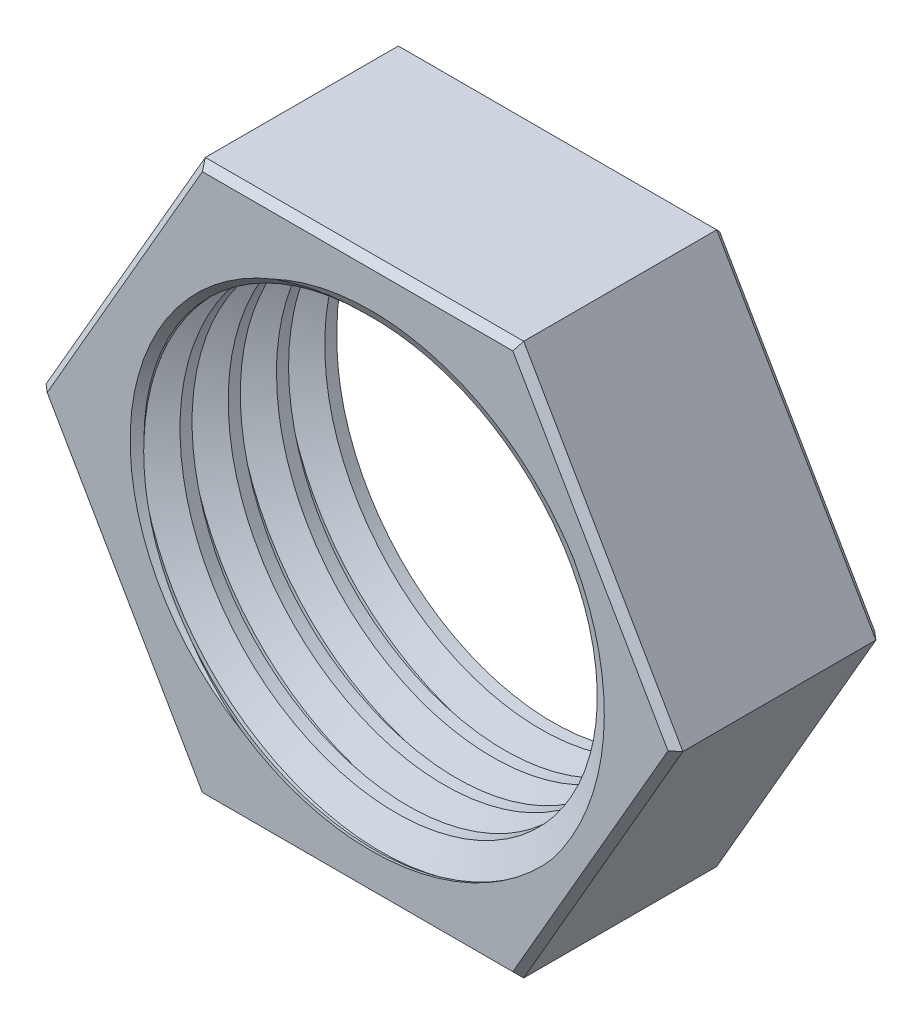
SolidWorks part; units mm, degrees
ref_plane "Front Plane" through (0, 0, 0) normal (0, 0, 1) x (1, 0, 0)
ref_plane "Top Plane" through (0, 0, 0) normal (0, 1, 0) x (1, 0, 0)
ref_plane "Right Plane" through (0, 0, 0) normal (1, 0, 0) x (0, 0, -1)
sketch "Sketch1" plane through (0, 0, 0) normal (0, 0, 1) x (1, 0, 0)
  line L1 (-23.094, 0) -> (-11.547, -20)
  line L2 (-11.547, -20) -> (11.547, -20)
  line L3 (11.547, -20) -> (23.094, 0)
  line L4 (23.094, 0) -> (11.547, 20)
  line L5 (11.547, 20) -> (-11.547, 20)
  line L6 (-11.547, 20) -> (-23.094, 0)
  circle A0 centre (0, 0) radius 20 construction
  circle A1 centre (0, 0) radius 16
  dimension "D2" = 32
  dimension "D1" = 40
extrude "Boss-Extrude1" add sketch "Sketch1" along normal blind 15
thread "Thread1" pitch 3.5 start angle 0, offset 3, length 20, pitch 3.5, diameter 32
ref_plane "Plane1" through (-16, 0, 18) normal (0, -1, 0) x (-1, 0, 0)
sketch "Thread Profile1" plane through (-16, 0, 18) normal (0, -1, 0) x (-1, 0, 0)
  line L0 (0, 0) -> (0, 3.5) construction
  line L1 (0, 0) -> (1.8944, 1.0937)
  line L2 (1.8944, 1.0937) -> (1.8944, 1.5312)
  line L3 (1.8944, 1.5312) -> (0, 2.625)
  line L4 (1.8944, 1.3125) -> (0, 1.3125) construction
  line L11 (0, 0) -> (0, 2.625)
  point P2 (0, 0)
  dimension "Pitch" = 3.5
  dimension "Profile_Angle" = 60
  dimension "Profile_Land" = 0.4375
  dimension "Profile_Height" = 1.8944
chamfer "Chamfer1" distance 0.5 angle 45 16 edges at (-17.3205, -10, 0) (0, -20, 0) (17.3205, -10, 0) (-17.3205, 10, 0) (17.3205, 10, 0) (0, 20, 0) (0, 20, 15) (-17.3205, 10, 15) (-17.3205, -10, 15) (0, -20, 15) (17.3205, -10, 15) (17.3205, 10, 15) (5.9761, -15.9119, 15) (16.4703, -3.5839, 0)
